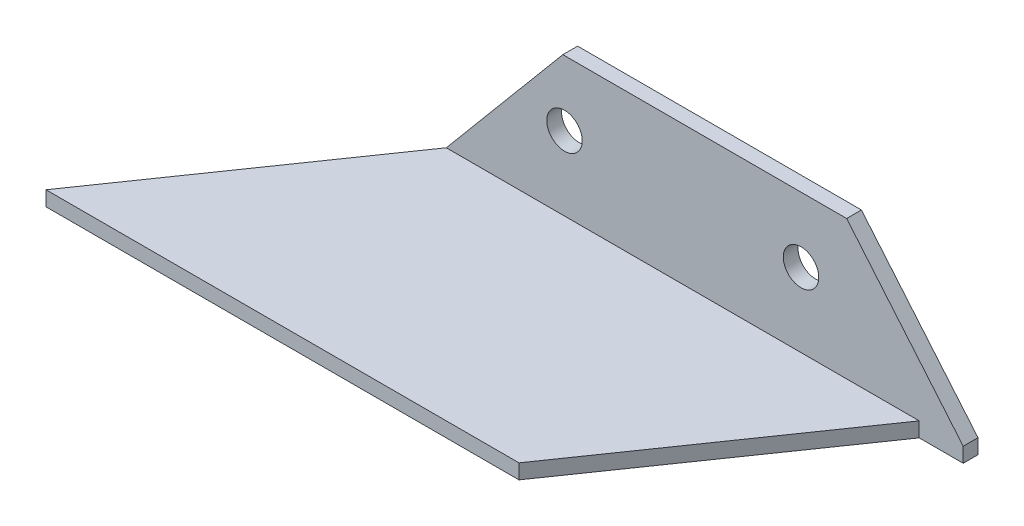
SolidWorks part; units mm, degrees
ref_plane "Front Plane" through (0, 0, 0) normal (0, 0, 1) x (1, 0, 0)
ref_plane "Top Plane" through (0, 0, 0) normal (0, 1, 0) x (1, 0, 0)
ref_plane "Right Plane" through (0, 0, 0) normal (1, 0, 0) x (0, 0, -1)
sketch "Sketch1" plane through (0, 0, 0) normal (0, 1, 0) x (1, 0, 0)
  line L0 (0, 0) -> (35.1756, 50.8)
  line L1 (35.1756, 50.8) -> (136.7756, 50.8)
  line L2 (136.7756, 50.8) -> (101.6, 0)
  line L3 (0, 0) -> (101.6, 0)
  dimension "D1" = 101.6
  dimension "D2" = 55.3
  dimension "D3" = 50.8
extrude "Boss-Extrude1" add sketch "Sketch1" along normal blind 3.175
ref_plane "Plane1" through (0, 0, -50.8) normal (0, 0, -1) x (-1, 0, 0)
sketch "Sketch3" plane through (0, 0, -50.8) normal (0, 0, -1) x (-1, 0, 0)
  line L0 (-35.1756, 3.175) -> (-60.2185, 33.02)
  line L1 (-60.2185, 33.02) -> (-121.1785, 33.02)
  line L2 (-121.1785, 33.02) -> (-146.2214, 3.175)
  line L3 (-136.7756, 3.175) -> (-35.1756, 3.175) construction
  line L4 (-146.2214, 3.175) -> (-146.2214, 0)
  line L5 (-146.2214, 0) -> (-35.1756, 0)
  line L6 (-35.1756, 0) -> (-35.1756, 3.175)
  dimension "D1" = 60.96
  dimension "D2" = 50
  dimension "D3" = 33.02
extrude "mt flange" add sketch "Sketch3" along normal blind 3.175
sketch "Sketch4" plane through (0, 0, -53.975) normal (0, 0, -1) x (-1, 0, 0)
  line L0 (-35.1756, 0) -> (-35.1756, 3.175) construction
  line L1 (-146.2214, 0) -> (-35.1756, 0) construction
  circle A0 centre (-60.5756, 19.05) radius 3.81
  circle A1 centre (-111.3756, 19.05) radius 3.81
  point P4 (-35.1756, 1.5875)
  dimension "D4" = 7.62
  dimension "D1" = 25.4
  dimension "D2" = 50.8
  dimension "D3" = 19.05
extrude "holes" cut sketch "Sketch4" against normal through all
